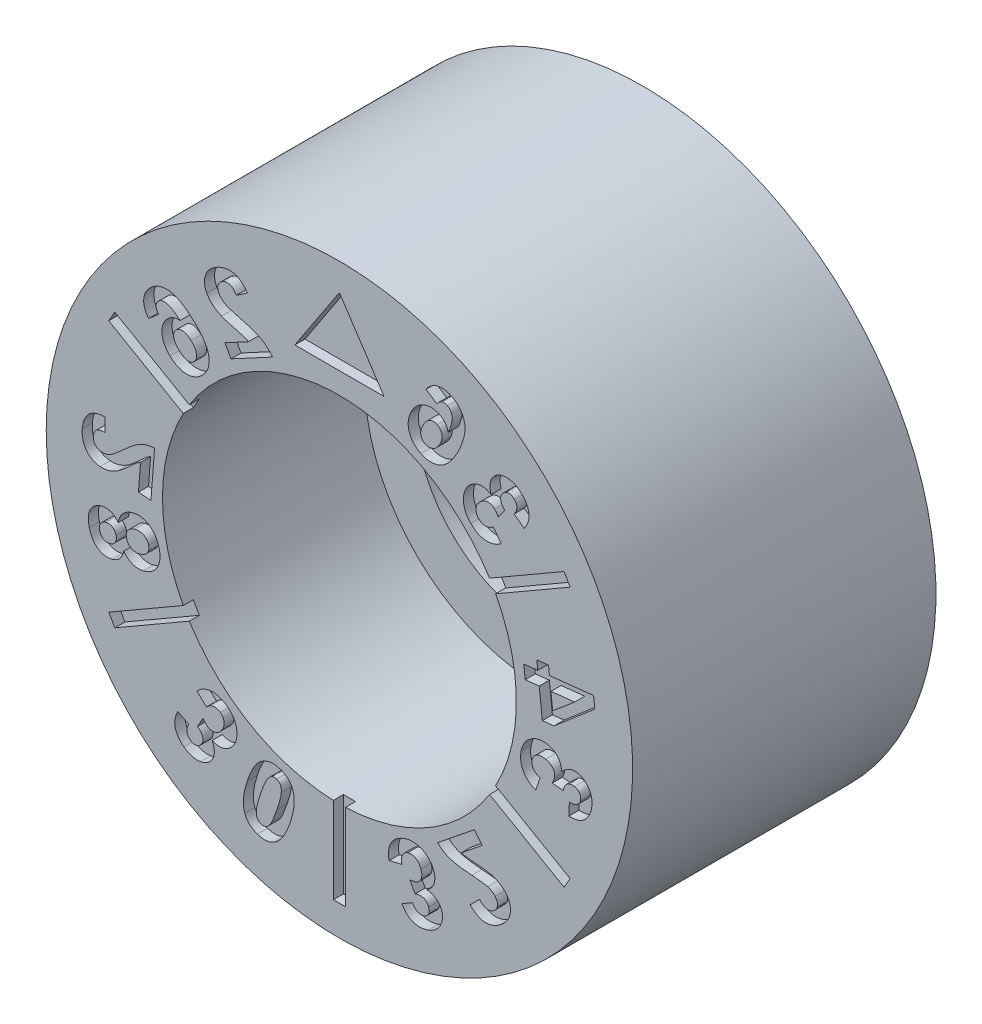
SolidWorks part; units mm, degrees
ref_plane "Front Plane" through (0, 0, 0) normal (0, 0, 1) x (1, 0, 0)
ref_plane "Top Plane" through (0, 0, 0) normal (0, 1, 0) x (1, 0, 0)
ref_plane "Right Plane" through (0, 0, 0) normal (1, 0, 0) x (0, 0, -1)
imported_body "Imported1"
other "Move Face2" parameters "D1"=0.157
other "DeleteFace1"
sketch "Sketch1" plane through (0, 0, 0) normal (0, 0, 1) x (1, 0, 0)
  line L0 (0, 0) -> (0, -3.3409) construction
  line L1 (0, 0) -> (-1.6705, -2.8933) construction
  line L3 (-0.06, -1.5) -> (0.06, -1.5)
  line L4 (-0.06, -1.5) -> (-0.06, -2.6)
  line L5 (-0.06, -2.6) -> (0.06, -2.6)
  line L6 (0.06, -1.5) -> (0.06, -2.6)
  line L11 (0, 0) -> (-2.8933, -1.6705) construction
  line L12 (-1.329, -0.698) -> (-1.269, -0.802)
  line L13 (-1.269, -0.802) -> (-2.2217, -1.352)
  line L14 (-1.329, -0.698) -> (-2.2817, -1.248)
  line L15 (-2.2817, -1.248) -> (-2.2217, -1.352)
  line L16 (0, 0) -> (-3.3409, 0) construction
  line L21 (0, 0) -> (-2.8933, 1.6705) construction
  line L22 (-1.269, 0.802) -> (-1.329, 0.698)
  line L23 (-1.329, 0.698) -> (-2.2817, 1.248)
  line L24 (-1.269, 0.802) -> (-2.2217, 1.352)
  line L25 (-2.2217, 1.352) -> (-2.2817, 1.248)
  line L26 (0, 0) -> (-1.6705, 2.8933) construction
  line L31 (0, 0) -> (0, 3.3409) construction
  line L36 (0, 0) -> (1.6705, 2.8933) construction
  line L41 (0, 0) -> (2.8933, 1.6705) construction
  line L42 (1.329, 0.698) -> (1.269, 0.802)
  line L43 (1.269, 0.802) -> (2.2217, 1.352)
  line L44 (1.329, 0.698) -> (2.2817, 1.248)
  line L45 (2.2817, 1.248) -> (2.2217, 1.352)
  line L46 (0, 0) -> (3.3409, 0) construction
  line L51 (0, 0) -> (2.8933, -1.6705) construction
  line L52 (1.269, -0.802) -> (1.329, -0.698)
  line L53 (1.329, -0.698) -> (2.2817, -1.248)
  line L54 (1.269, -0.802) -> (2.2217, -1.352)
  line L55 (2.2217, -1.352) -> (2.2817, -1.248)
  line L56 (0, 0) -> (1.6705, -2.8933) construction
  line L61 (0.06, 1.5) -> (0.06, 2.6)
  line L62 (-0.06, 1.5) -> (-0.06, 2.6)
  line L63 (0.06, 1.5) -> (-0.06, 1.5)
  line L64 (0.06, 2.6) -> (-0.06, 2.6)
  line L65 (0.802, 1.269) -> (1.352, 2.2217)
  line L66 (0.698, 1.329) -> (1.248, 2.2817)
  line L67 (1.352, 2.2217) -> (1.248, 2.2817)
  line L68 (0.802, 1.269) -> (0.698, 1.329)
  line L69 (-0.698, 1.329) -> (-1.248, 2.2817)
  line L70 (-1.248, 2.2817) -> (-1.352, 2.2217)
  line L71 (-0.802, 1.269) -> (-1.352, 2.2217)
  line L72 (-0.698, 1.329) -> (-0.802, 1.269)
  line L73 (1.5, 0.06) -> (2.6, 0.06)
  line L74 (1.5, -0.06) -> (2.6, -0.06)
  line L75 (1.5, -0.06) -> (1.5, 0.06)
  line L76 (2.6, -0.06) -> (2.6, 0.06)
  line L77 (-1.5, 0.06) -> (-2.6, 0.06)
  line L78 (-1.5, -0.06) -> (-2.6, -0.06)
  line L79 (-1.5, 0.06) -> (-1.5, -0.06)
  line L80 (-2.6, 0.06) -> (-2.6, -0.06)
  line L81 (0.802, -1.269) -> (1.352, -2.2217)
  line L82 (0.698, -1.329) -> (1.248, -2.2817)
  line L83 (-0.698, -1.329) -> (-1.248, -2.2817)
  line L84 (-0.802, -1.269) -> (-1.352, -2.2217)
  line L85 (-0.802, -1.269) -> (-0.698, -1.329)
  line L86 (0.698, -1.329) -> (0.802, -1.269)
  line L87 (1.248, -2.2817) -> (1.352, -2.2217)
  line L88 (-1.352, -2.2217) -> (-1.248, -2.2817)
  arc A0 (-0.6417, 1.7581) -> (0, 1.8715) centre (0, 0) ccw construction
  text T0 "26  28  30  32  34  36" font "Arial" height 0.7
  point P66 (0, 0)
  dimension "D1" = 3.743
  dimension "D6" = 12
extrude "Cut-Extrude1" cut sketch "Sketch1" against normal blind 0.1
